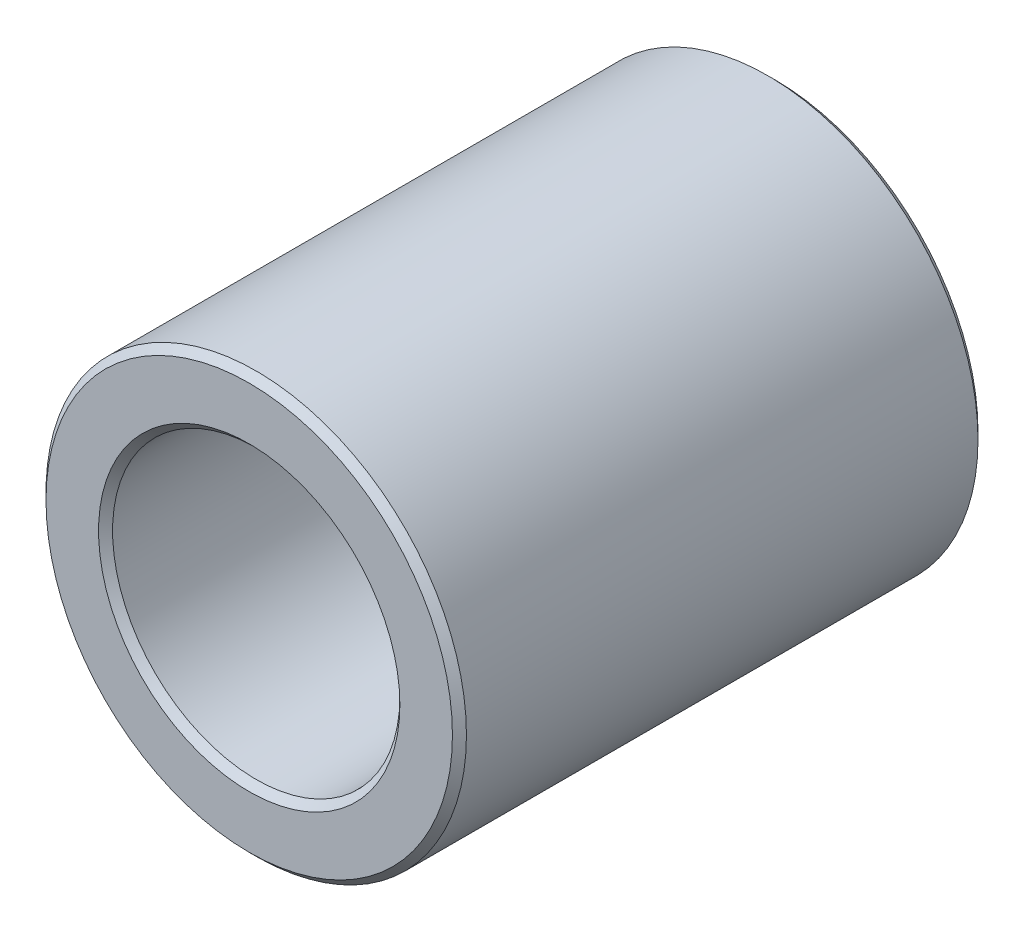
SolidWorks part; units mm, degrees
ref_plane "Front Plane" through (0, 0, 0) normal (0, 0, 1) x (1, 0, 0)
ref_plane "Top Plane" through (0, 0, 0) normal (0, 1, 0) x (1, 0, 0)
ref_plane "Right Plane" through (0, 0, 0) normal (1, 0, 0) x (0, 0, -1)
sketch "Sketch1" plane through (0, 0, 0) normal (0, 0, 1) x (1, 0, 0)
  circle A0 centre (0, 0) radius 6
  circle A1 centre (0, 0) radius 4.1
  dimension "D1" = 12
  dimension "D2" = 8.2
extrude "Boss-Extrude2" add sketch "Sketch1" along normal mid plane 15
chamfer "Chamfer3" distance 0.2 angle 45 4 edges at (6, 0, 7.5) (6, 0, -7.5) (4.1, 0, -7.5) (4.1, 0, 7.5)
